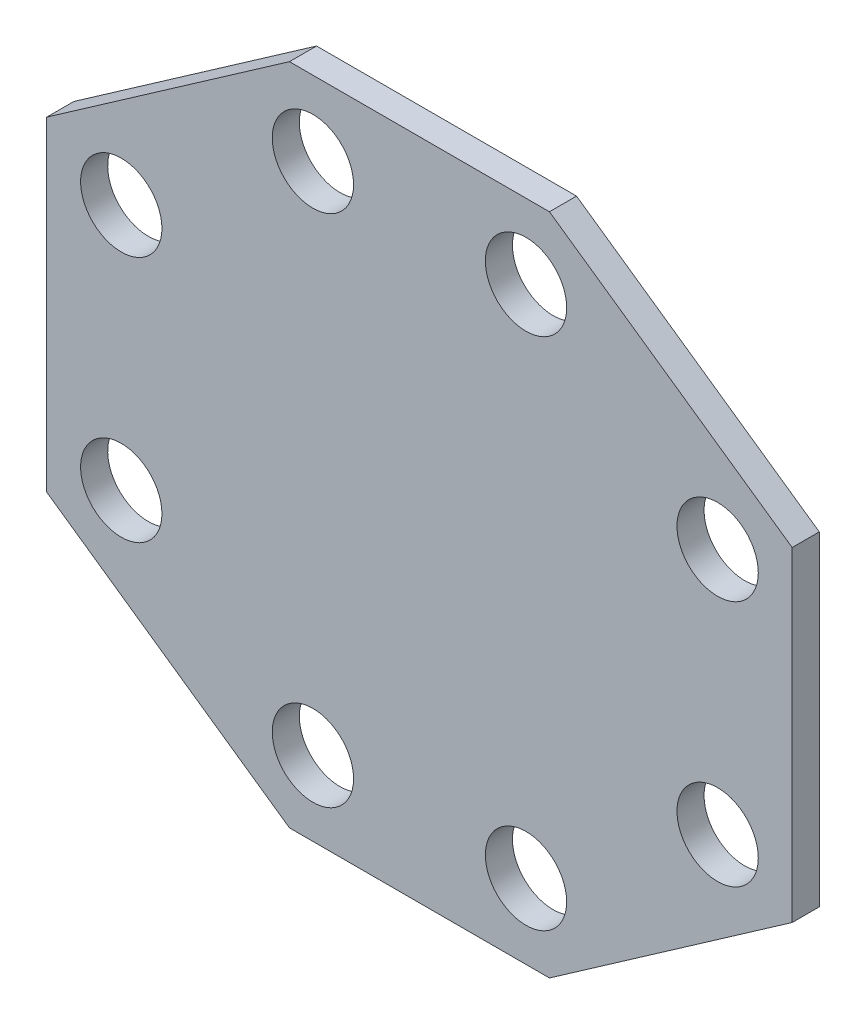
SolidWorks part; units mm, degrees
ref_plane "Front Plane" through (0, 0, 0) normal (1, 0, 0) x (0, 1, 0)
ref_plane "Top Plane" through (0, 0, 0) normal (0, 0, 1) x (0, 1, 0)
ref_plane "Right Plane" through (0, 0, 0) normal (0, 1, 0) x (-1, 0, 0)
sketch "sk W14x730" plane through (0, 0, 0) normal (0, 0, 1) x (0, 1, 0)
  point P0 (0, -284.734)
  point P1 (-38.989, 0)
  line B0 (-227.203, -284.734) -> (-227.203, -160.02)
  line B1 (-227.203, -160.02) -> (-54.229, -160.02)
  line B2 (-38.989, -144.78) -> (-38.989, 144.78)
  line B3 (-54.229, 160.02) -> (-227.203, 160.02)
  line B4 (-227.203, 160.02) -> (-227.203, 284.734)
  line B5 (-227.203, 284.734) -> (227.203, 284.734)
  line B6 (227.203, 284.734) -> (227.203, 160.02)
  line B7 (227.203, 160.02) -> (54.229, 160.02)
  line B8 (38.989, 144.78) -> (38.989, -144.78)
  line B9 (54.229, -160.02) -> (227.203, -160.02)
  line B10 (227.203, -160.02) -> (227.203, -284.734)
  line B11 (227.203, -284.734) -> (-227.203, -284.734)
  arc B12 (-54.229, -160.02) -> (-38.989, -144.78) centre (-54.229, -144.78) ccw
  arc B13 (-38.989, 144.78) -> (-54.229, 160.02) centre (-54.229, 144.78) ccw
  arc B14 (54.229, 160.02) -> (38.989, 144.78) centre (54.229, 144.78) ccw
  arc B15 (38.989, -144.78) -> (54.229, -160.02) centre (54.229, -144.78) ccw
sketch_block_instance "W14x730-113"
sketch_block "W14x730" parameters "D4"=15.24, "D1"=454.406, "D2"=569.468, "D3"=77.978, "D5"=124.714
sketch_block_instance "W14x730-232"
sketch_block_instance "W14x730-233"
sketch_block_instance "W14x730-234"
sketch_block_instance "W14x730-276"
sketch_block_instance "W14x730-277"
sketch_block_instance "W14x730-278"
sketch_block_instance "W14x730-279"
sketch_block_instance "W14x730-280"
sketch_block_instance "W14x730-281"
sketch_block_instance "W14x730-282"
sketch_block_instance "W14x730-283"
sketch_block_instance "W14x730-284"
sketch_block_instance "W14x730-285"
sketch_block_instance "W14x730-286"
sketch_block_instance "W14x730-287"
sketch_block_instance "W14x730-288"
sketch_block_instance "W14x730-289"
sketch_block_instance "W14x730-321"
sketch_block_instance "W14x730-322"
sketch_block_instance "W14x730-323"
sketch_block_instance "W14x730-324"
sketch_block_instance "W14x730-325"
sketch_block_instance "W14x730-326"
sketch_block_instance "W14x730-327"
sketch_block_instance "W14x730-328"
sketch_block_instance "W14x730-329"
sketch_block_instance "W14x730-330"
sketch_block_instance "W14x730-331"
sketch_block_instance "W14x730-332"
sketch_block_instance "W14x730-333"
sketch_block_instance "W14x730-334"
sketch_block_instance "W14x730-335"
sketch_block_instance "W14x730-336"
sketch_block_instance "W14x730-337"
sketch_block_instance "W14x730-338"
sketch_block_instance "W14x730-339"
sketch_block_instance "W14x730-340"
sketch_block_instance "W14x730-341"
sketch_block_instance "W14x730-365"
sketch_block_instance "W14x730-366"
sketch_block_instance "W14x730-367"
sketch_block_instance "W14x730-368"
sketch_block_instance "W14x730-369"
sketch_block_instance "W14x730-370"
sketch_block_instance "W14x730-371"
sketch_block_instance "W14x730-372"
sketch_block_instance "W14x730-373"
sketch_block_instance "W14x730-374"
sketch_block_instance "W14x730-375"
sketch_block_instance "W14x730-376"
sketch_block_instance "W14x730-377"
sketch_block_instance "W14x730-378"
sketch_block_instance "W14x730-379"
sketch_block_instance "W14x730-380"
sketch_block_instance "W14x730-381"
sketch_block_instance "W14x730-382"
sketch_block_instance "W14x730-383"
sketch_block_instance "W14x730-384"
sketch_block_instance "W14x730-385"
sketch_block_instance "W14x730-386"
sketch_block_instance "W14x730-387"
sketch_block_instance "W14x730-388"
sketch_block_instance "W14x730-389"
sketch_block_instance "W14x730-390"
sketch_block_instance "W14x730-391"
sketch_block_instance "W14x730-410"
sketch_block_instance "W14x730-411"
sketch_block_instance "W14x730-412"
sketch_block_instance "W14x730-413"
sketch_block_instance "W14x730-414"
sketch_block_instance "W14x730-415"
sketch_block_instance "W14x730-416"
sketch_block_instance "W14x730-417"
sketch_block_instance "W14x730-418"
sketch_block_instance "W14x730-419"
sketch_block_instance "W14x730-420"
sketch_block_instance "W14x730-421"
sketch_block_instance "W14x730-422"
sketch_block_instance "W14x730-423"
sketch_block_instance "W14x730-424"
sketch_block_instance "W14x730-425"
sketch_block_instance "W14x730-426"
sketch_block_instance "W14x730-427"
sketch_block_instance "W14x730-428"
sketch_block_instance "W14x730-429"
sketch_block_instance "W14x730-430"
sketch_block_instance "W14x730-431"
sketch_block_instance "W14x730-432"
sketch_block_instance "W14x730-433"
sketch_block_instance "W14x730-434"
sketch_block_instance "W14x730-435"
sketch_block_instance "W14x730-436"
sketch_block_instance "W14x730-437"
sketch_block_instance "W14x730-438"
sketch_block_instance "W14x730-439"
sketch_block_instance "W14x730-440"
sketch_block_instance "W14x730-443"
sketch_block_instance "W14x730-454"
sketch_block_instance "W14x730-455"
sketch_block_instance "W14x730-456"
sketch_block_instance "W14x730-457"
sketch_block_instance "W14x730-458"
sketch_block_instance "W14x730-459"
sketch_block_instance "W14x730-460"
sketch_block_instance "W14x730-461"
sketch_block_instance "W14x730-462"
sketch_block_instance "W14x730-463"
sketch_block_instance "W14x730-464"
sketch_block_instance "W14x730-465"
sketch_block_instance "W14x730-466"
sketch_block_instance "W14x730-467"
sketch_block_instance "W14x730-468"
sketch_block_instance "W14x730-469"
sketch_block_instance "W14x730-470"
sketch_block_instance "W14x730-471"
sketch_block_instance "W14x730-472"
sketch_block_instance "W14x730-473"
sketch_block_instance "W14x730-474"
sketch_block_instance "W14x730-475"
sketch_block_instance "W14x730-476"
sketch_block_instance "W14x730-477"
sketch_block_instance "W14x730-478"
sketch_block_instance "W14x730-479"
sketch_block_instance "W14x730-480"
sketch_block_instance "W14x730-481"
sketch_block_instance "W14x730-482"
sketch_block_instance "W14x730-483"
sketch_block_instance "W14x730-484"
sketch_block_instance "W14x730-485"
sketch_block_instance "W14x730-486"
sketch_block_instance "W14x730-487"
sketch_block_instance "W14x730-488"
sketch_block_instance "W14x730-489"
sketch_block_instance "W14x730-490" parameters "D1"=817.9177, "D2"=1027.7361, "D3"=0.4058, "D4"=24.0009, "D5"=0.4058, "D6"=533.4, "D7"=27.3509, "D8"=8374.3758, "D9"=3499.6788, "D10"=18059.4
sketch "sk 4\" hex nut Pattern" plane through (0, 0, 0) normal (0, 0, 1) x (0, 1, 0)
  line L7 (419.0803, -173.5887) -> (419.0803, 173.5887)
  line L8 (419.0803, 173.5887) -> (173.5887, 419.0803)
  line L9 (173.5887, 419.0803) -> (-173.5887, 419.0803)
  line L10 (-173.5887, 419.0803) -> (-419.0803, 173.5887)
  line L11 (-419.0803, 173.5887) -> (-419.0803, -173.5887)
  line L12 (-419.0803, -173.5887) -> (-173.5887, -419.0803)
  line L13 (-173.5887, -419.0803) -> (173.5887, -419.0803)
  line L14 (173.5887, -419.0803) -> (419.0803, -173.5887)
  line L29 (54.229, -125.02) -> (262.203, -125.02)
  line L30 (262.203, -125.02) -> (262.203, -319.734)
  line L31 (-262.203, -125.02) -> (-54.229, -125.02)
  line L32 (-262.203, -319.734) -> (-262.203, -125.02)
  line L33 (262.203, -319.734) -> (-262.203, -319.734)
  line L34 (54.229, -125.02) -> (262.203, -125.02)
  line L35 (262.203, -125.02) -> (262.203, -319.734)
  line L36 (-262.203, -125.02) -> (-54.229, -125.02)
  line L37 (-262.203, -319.734) -> (-262.203, -125.02)
  line L38 (262.203, -319.734) -> (-262.203, -319.734)
  line L39 (-419.0803, 173.5887) -> (419.0803, -173.5887)
  line L40 (419.0803, 173.5887) -> (-419.0803, -173.5887)
  line L42 (-466.3243, 523.8553) -> (466.3243, 523.8553)
  line L43 (-466.3243, 523.8553) -> (-466.3243, -523.8553)
  line L44 (262.203, 125.02) -> (54.229, 125.02)
  line L45 (262.203, 319.734) -> (262.203, 125.02)
  line L46 (-262.203, 319.734) -> (262.203, 319.734)
  line L47 (-262.203, 125.02) -> (-262.203, 319.734)
  line L48 (-54.229, 125.02) -> (-262.203, 125.02)
  line L49 (262.203, 125.02) -> (54.229, 125.02)
  line L50 (262.203, 319.734) -> (262.203, 125.02)
  line L51 (-262.203, 319.734) -> (262.203, 319.734)
  line L52 (-262.203, 125.02) -> (-262.203, 319.734)
  line L53 (-54.229, 125.02) -> (-262.203, 125.02)
  line L54 (-466.3243, -523.8553) -> (466.3243, -523.8553)
  line L55 (466.3243, 523.8553) -> (466.3243, -523.8553)
  circle A0 centre (0, 0) radius 419.0803 construction
  line B0 (-128.6781, -496.8678) -> (-83.7675, -419.0803)
  circle B1 centre (-173.5887, -419.0803) radius 77.7875 construction
  circle B2 centre (-173.5887, -419.0803) radius 50.8
  circle B3 centre (-173.5887, -419.0803) radius 89.8213
  circle B4 centre (-173.5887, -419.0803) radius 99.3463
  line B5 (-83.7675, 419.0803) -> (-128.6781, 496.8678)
  line B6 (-128.6781, 496.8678) -> (-218.4994, 496.8678)
  line B7 (-218.4994, 496.8678) -> (-263.41, 419.0803)
  line B8 (-263.41, 419.0803) -> (-218.4994, 341.2928)
  line B9 (-218.4994, 341.2928) -> (-128.6781, 341.2928)
  circle B10 centre (-173.5887, 419.0803) radius 77.7875 construction
  circle B11 centre (-173.5887, 419.0803) radius 50.8
  circle B12 centre (-173.5887, 419.0803) radius 89.8213
  circle B13 centre (-173.5887, 419.0803) radius 99.3463
  line B14 (263.41, 419.0803) -> (218.4994, 496.8678)
  line B15 (218.4994, 496.8678) -> (128.6781, 496.8678)
  line B16 (128.6781, 496.8678) -> (83.7675, 419.0803)
  line B17 (128.6781, 341.2928) -> (218.4994, 341.2928)
  line B18 (218.4994, 341.2928) -> (263.41, 419.0803)
  circle B19 centre (173.5887, 419.0803) radius 50.8
  circle B20 centre (173.5887, 419.0803) radius 89.8213
  circle B21 centre (173.5887, 419.0803) radius 99.3463
  line B22 (263.41, -419.0803) -> (218.4994, -341.2928)
  line B23 (218.4994, -341.2928) -> (128.6781, -341.2928)
  line B24 (83.7675, -419.0803) -> (128.6781, -496.8678)
  line B25 (128.6781, -496.8678) -> (218.4994, -496.8678)
  line B26 (218.4994, -496.8678) -> (263.41, -419.0803)
  circle B27 centre (173.5887, -419.0803) radius 77.7875 construction
  circle B28 centre (173.5887, -419.0803) radius 50.8
  circle B29 centre (173.5887, -419.0803) radius 89.8213
  circle B30 centre (173.5887, -419.0803) radius 99.3463
  line B31 (-271.728, 149.7586) -> (-316.6386, 227.5461)
  line B32 (-316.6386, 227.5461) -> (-406.4599, 227.5461)
  line B33 (-406.4599, 227.5461) -> (-451.3705, 149.7586)
  line B34 (-451.3705, 149.7586) -> (-406.4599, 71.9711)
  line B35 (-406.4599, 71.9711) -> (-316.6386, 71.9711)
  circle B36 centre (-361.5493, 149.7586) radius 77.7875 construction
  circle B37 centre (-361.5493, 149.7586) radius 50.8
  circle B38 centre (-361.5493, 149.7586) radius 89.8213
  circle B39 centre (-361.5493, 149.7586) radius 99.3463
  line B40 (-271.728, -149.7586) -> (-316.6386, -71.9711)
  line B41 (-316.6386, -71.9711) -> (-406.4599, -71.9711)
  line B42 (-406.4599, -71.9711) -> (-451.3705, -149.7586)
  line B43 (-451.3705, -149.7586) -> (-406.4599, -227.5461)
  line B44 (-406.4599, -227.5461) -> (-316.6386, -227.5461)
  line B45 (-316.6386, -227.5461) -> (-271.728, -149.7586)
  circle B46 centre (-361.5493, -149.7586) radius 77.7875 construction
  circle B47 centre (-361.5493, -149.7586) radius 50.8
  circle B48 centre (-361.5493, -149.7586) radius 89.8213
  circle B49 centre (-361.5493, -149.7586) radius 99.3463
  line B50 (451.3705, 149.7586) -> (406.4599, 227.5461)
  line B51 (406.4599, 227.5461) -> (316.6386, 227.5461)
  line B52 (316.6386, 227.5461) -> (271.728, 149.7586)
  line B53 (316.6386, 71.9711) -> (406.4599, 71.9711)
  circle B54 centre (361.5493, 149.7586) radius 77.7875 construction
  circle B55 centre (361.5493, 149.7586) radius 50.8
  circle B56 centre (361.5493, 149.7586) radius 89.8213
  circle B57 centre (361.5493, 149.7586) radius 99.3463
  line B58 (316.6386, -71.9711) -> (271.728, -149.7586)
  line B59 (406.4599, -227.5461) -> (451.3705, -149.7586)
  circle B60 centre (361.5493, -149.7586) radius 77.7875 construction
  circle B61 centre (361.5493, -149.7586) radius 50.8
  circle B62 centre (361.5493, -149.7586) radius 89.8213
  circle B63 centre (361.5493, -149.7586) radius 99.3463
sketch_block_instance "4\" hex nut-1"
sketch_block "4\" hex nut" parameters "D1"=155.575, "D2"=101.6, "D3"=9.525
sketch_block_instance "4\" hex nut-2"
sketch_block_instance "4\" hex nut-3"
sketch_block_instance "4\" hex nut-4"
sketch_block_instance "4\" hex nut-5"
sketch_block_instance "4\" hex nut-6"
sketch_block_instance "4\" hex nut-7"
sketch_block_instance "4\" hex nut-8" parameters "D1"=129.9071, "D2"=77.383, "D3"=138.8929, "D4"=187.7059, "D5"=195.0068, "D6"=231.3326
sketch "Sketch3" plane through (0, 0, 0) normal (0, 0, 1) x (0, 1, 0)
  line L0 (-466.3243, 523.8553) -> (466.3243, 523.8553) construction
  line L1 (466.3243, 523.8553) -> (466.3243, -523.8553) construction
  line L2 (-466.3243, -523.8553) -> (466.3243, -523.8553) construction
  line L3 (-466.3243, 523.8553) -> (-466.3243, -523.8553) construction
  line L4 (228.2342, 523.8553) -> (466.3243, 182.7049)
  line L5 (466.3243, 182.7049) -> (466.3243, -182.7049)
  line L6 (466.3243, -182.7049) -> (228.2342, -523.8553)
  line L7 (228.2342, -523.8553) -> (-228.2342, -523.8553)
  line L8 (-228.2342, -523.8553) -> (-466.3243, -182.7049)
  line L9 (-466.3243, -182.7049) -> (-466.3243, 182.7049)
  line L10 (-466.3243, 182.7049) -> (-228.2342, 523.8553)
  line L11 (-228.2342, 523.8553) -> (228.2342, 523.8553)
  line L93 (-54.229, 156.845) -> (-230.378, 156.845)
  line L94 (-230.378, 156.845) -> (-230.378, 287.909)
  line L95 (230.378, 156.845) -> (54.229, 156.845)
  line L96 (230.378, 287.909) -> (230.378, 156.845)
  line L97 (-230.378, 287.909) -> (230.378, 287.909)
  line L98 (-54.229, 156.845) -> (-230.378, 156.845) construction
  line L99 (-230.378, 156.845) -> (-230.378, 287.909) construction
  line L100 (230.378, 156.845) -> (54.229, 156.845) construction
  line L101 (230.378, 287.909) -> (230.378, 156.845) construction
  line L102 (-230.378, 287.909) -> (230.378, 287.909) construction
  line L118 (54.229, -156.845) -> (230.378, -156.845)
  line L119 (230.378, -156.845) -> (230.378, -287.909)
  line L120 (230.378, -287.909) -> (-230.378, -287.909)
  line L121 (-230.378, -287.909) -> (-230.378, -156.845)
  line L122 (-230.378, -156.845) -> (-54.229, -156.845)
  line L123 (54.229, -156.845) -> (230.378, -156.845) construction
  line L124 (230.378, -156.845) -> (230.378, -287.909) construction
  line L125 (230.378, -287.909) -> (-230.378, -287.909) construction
  line L126 (-230.378, -287.909) -> (-230.378, -156.845) construction
  line L127 (-230.378, -156.845) -> (-54.229, -156.845) construction
  line L130 (42.164, 144.78) -> (42.164, -144.78)
  line L131 (42.164, 144.78) -> (42.164, -144.78) construction
  line L132 (-54.229, 156.845) -> (-42.164, 144.78) construction
  line L133 (-42.164, -144.78) -> (-42.164, 144.78)
  line L134 (-42.164, -144.78) -> (-42.164, 144.78) construction
  line L135 (42.164, 144.78) -> (54.229, 156.845) construction
  line L136 (42.164, -144.78) -> (54.229, -156.845) construction
  line L137 (-54.229, -156.845) -> (-42.164, -144.78) construction
  circle A0 centre (173.5887, 419.0803) radius 104.775 construction
  circle A1 centre (-173.5887, 419.0803) radius 104.775 construction
  circle A2 centre (-361.5493, 149.7586) radius 104.775 construction
  circle A3 centre (-361.5493, -149.7586) radius 104.775 construction
  circle A4 centre (-173.5887, -419.0803) radius 104.775 construction
  circle A5 centre (173.5887, -419.0803) radius 104.775 construction
  circle A6 centre (361.5493, -149.7586) radius 104.775 construction
  circle A7 centre (361.5493, 149.7586) radius 104.775 construction
  dimension "D1" = 3.175
  dimension "D2" = 3.175
  dimension "D3" = 3.175
  dimension "D4" = 3.175
extrude "Main Plate" add sketch "Sketch3" along normal blind 38.1
sketch "Sketch5" plane through (0, 0, 0) normal (0, 0, 1) x (0, 1, 0)
  circle A0 centre (-173.5887, 419.0803) radius 57.15
  circle A1 centre (173.5887, 419.0803) radius 57.15
  circle A2 centre (361.5493, 149.7586) radius 57.15
  circle A3 centre (361.5493, -149.7586) radius 57.15
  circle A4 centre (173.5887, -419.0803) radius 57.15
  circle A5 centre (-173.5887, -419.0803) radius 57.15
  circle A6 centre (-361.5493, -149.7586) radius 57.15
  circle A7 centre (-361.5493, 149.7586) radius 57.15
  dimension "D1" = 114.3
  dimension "D2" = 114.3
  dimension "D3" = 114.3
  dimension "D4" = 114.3
  dimension "D5" = 114.3
  dimension "D6" = 114.3
  dimension "D7" = 114.3
  dimension "D8" = 114.3
extrude "Cut-Extrude1" cut sketch "Sketch5" against normal through all both and the other way through all
